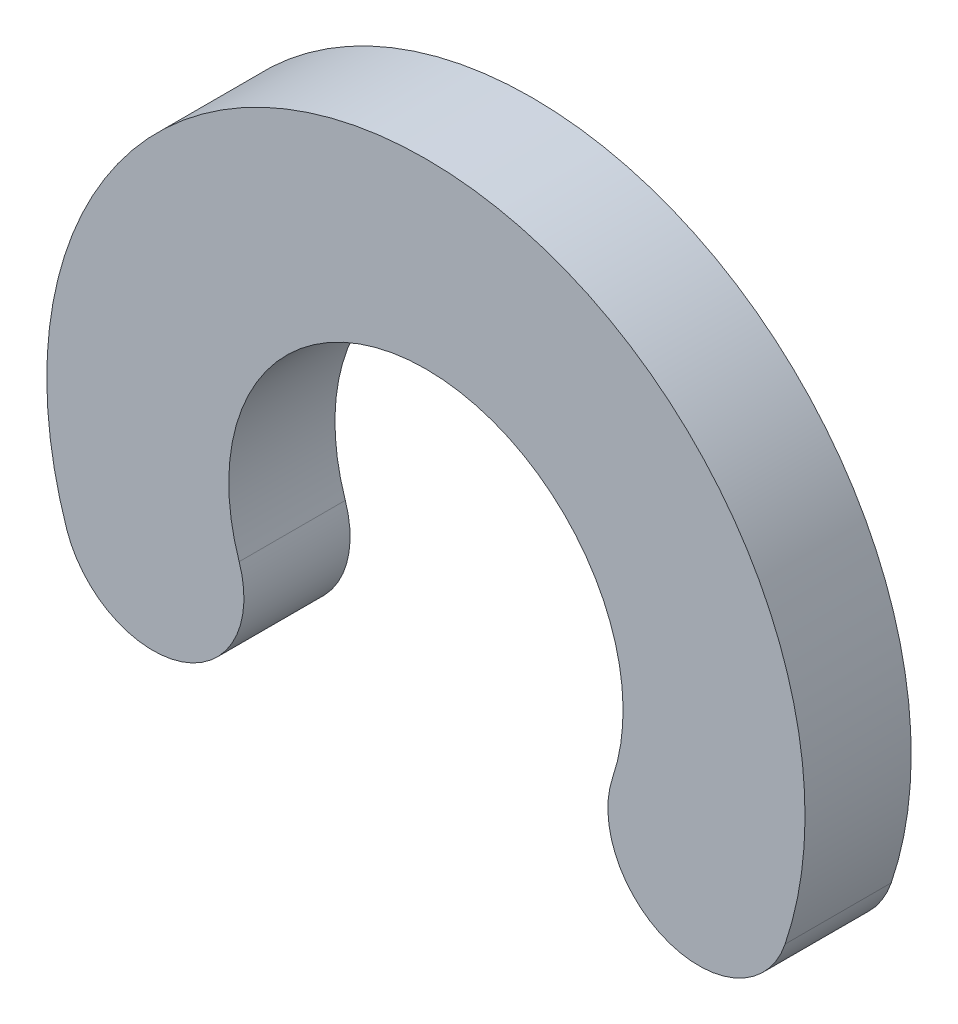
SolidWorks part; units mm, degrees
ref_plane "Front" through (0, 0, 0) normal (0, 0, 1) x (1, 0, 0)
ref_plane "Top" through (0, 0, 0) normal (0, 1, 0) x (1, 0, 0)
ref_plane "Right" through (0, 0, 0) normal (1, 0, 0) x (0, 0, -1)
other "Configuration Table"
sketch "Sketch1" plane through (0, 0, 0) normal (0, 0, 1) x (1, 0, 0)
  line L0 (0, 1.5089) -> (0, -1.7832) construction
  arc A0 (0.6158, -0.2081) -> (-0.6158, -0.2081) centre (0, 0) ccw
  arc A1 (1.1842, -0.4002) -> (-1.1842, -0.4002) centre (0, 0) ccw
  arc A2 (0.6158, -0.2081) -> (1.1842, -0.4002) centre (0.9, -0.3041) ccw
  arc A3 (-0.6158, -0.2081) -> (-1.1842, -0.4002) centre (-0.9, -0.3041) cw
  dimension "R" = 0.65
  dimension "r1" = 0.3
  dimension "B0" = 1.2
  dimension "b" = 0.6
extrude "Body" add sketch "Sketch1" against normal blind 0.35
